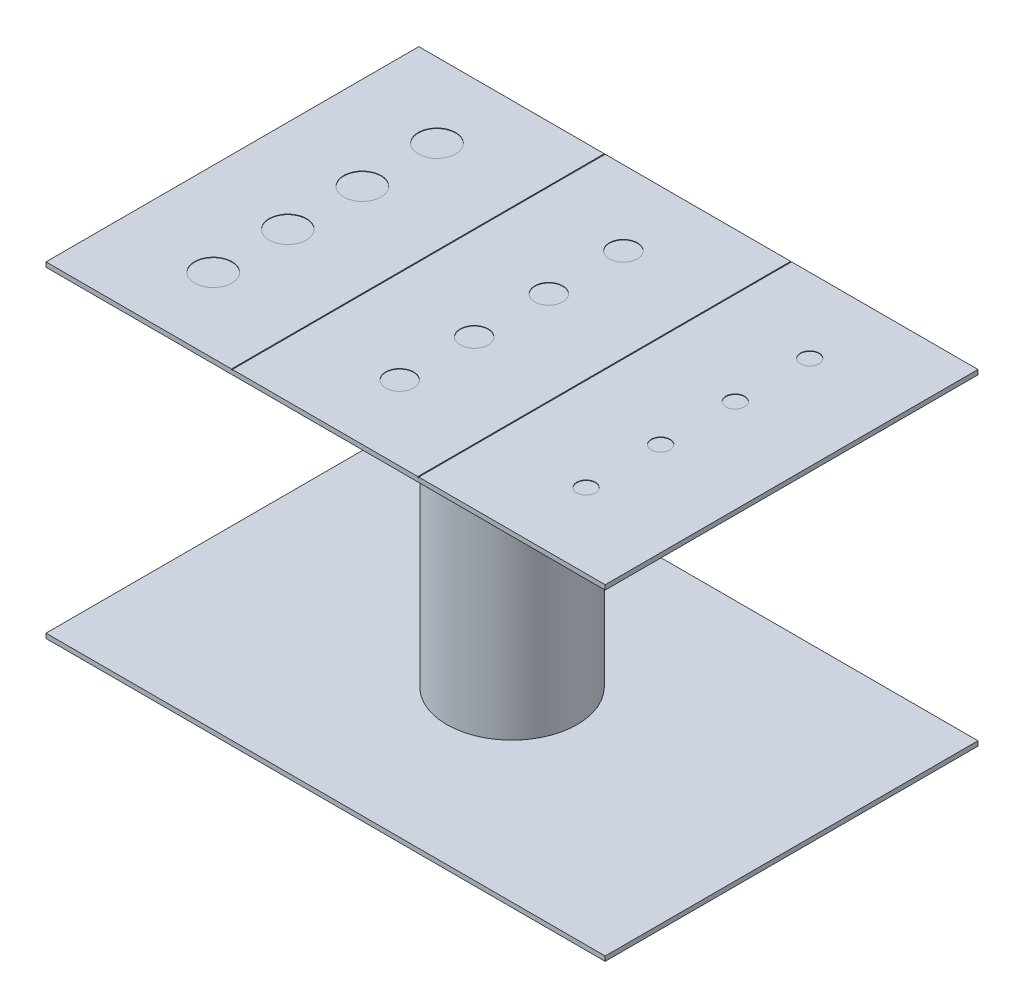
SolidWorks part; units mm, degrees
ref_plane "Front Plane" through (0, 0, 0) normal (0, 0, 1) x (1, 0, 0)
ref_plane "Top Plane" through (0, 0, 0) normal (0, 1, 0) x (1, 0, 0)
ref_plane "Right Plane" through (0, 0, 0) normal (1, 0, 0) x (0, 0, -1)
sketch "Sketch1" plane through (0, 0, 0) normal (0, 1, 0) x (1, 0, 0)
  line L1 (-300, 200) -> (300, 200)
  line L2 (-300, 200) -> (-300, -200)
  line L3 (-300, -200) -> (300, -200)
  line L4 (300, 200) -> (300, -200)
  line L5 (-300, 200) -> (300, -200) construction
  line L6 (-300, -200) -> (300, 200) construction
  point P0 (0, 0)
  dimension "D1" = 600
  dimension "D2" = 400
extrude "Boss-Extrude1" add sketch "Sketch1" along normal blind 5
sketch "Sketch2" plane through (0, 5, 0) normal (0, 1, 0) x (1, 0, 0)
  circle A0 centre (0, 0) radius 70
  dimension "D1" = 140
extrude "Boss-Extrude2" add sketch "Sketch2" along normal blind 340
sketch "Sketch3" plane through (0, 345, 0) normal (0, 1, 0) x (1, 0, 0)
  line L1 (-300, 200) -> (300, 200)
  line L2 (-300, 200) -> (-300, -200)
  line L3 (-300, -200) -> (300, -200)
  line L4 (300, 200) -> (300, -200)
  line L5 (-300, 200) -> (300, -200) construction
  line L6 (-300, -200) -> (300, 200) construction
  point P0 (0, 0)
extrude "Boss-Extrude3" add sketch "Sketch3" along normal blind 5
sketch "Sketch4" plane through (0, 350, 0) normal (0, 1, 0) x (1, 0, 0)
  line L1 (100, 200) -> (100, -200)
  line L2 (-100, 200) -> (-100, -200)
extrude "Cut-Extrude-Thin1" cut sketch "Sketch4" against normal blind 1 thin
sketch "Sketch6" plane through (0, 350, 0) normal (0, 1, 0) x (1, 0, 0)
  line L0 (-0.5, -200) -> (199.5, -200)
  line L1 (-100, -200) -> (99, -200) construction
  line L2 (100, -200) -> (300, -200) construction
  line L3 (-0.5, -200) -> (-200.5, -200)
  line L4 (-300, -200) -> (-101, -200) construction
  circle A0 centre (-200.5, -200) radius 20
  circle A1 centre (-0.5, -200) radius 15
  circle A2 centre (199.5, -200) radius 10
  circle A3 centre (-200.5, -120) radius 20
  circle A4 centre (-0.5, -120) radius 15
  circle A5 centre (199.5, -120) radius 10
  circle A6 centre (-200.5, -40) radius 20
  circle A7 centre (-0.5, -40) radius 15
  circle A8 centre (199.5, -40) radius 10
  circle A9 centre (-200.5, 40) radius 20
  circle A10 centre (-0.5, 40) radius 15
  circle A11 centre (199.5, 40) radius 10
  circle A12 centre (-200.5, 120) radius 20
  circle A13 centre (-0.5, 120) radius 15
  circle A14 centre (199.5, 120) radius 10
  dimension "D3" = 40
  dimension "D4" = 30
  dimension "D5" = 20
  dimension "D1" = 200
  dimension "D2" = 200
  dimension "D6" = 5
extrude "Cut-Extrude1" cut sketch "Sketch6" against normal blind 0.5 contours A12 | A13 | A14 | A11 | A8 | A5 | A4 | A7 | A10 | A9 | A6 | A3
